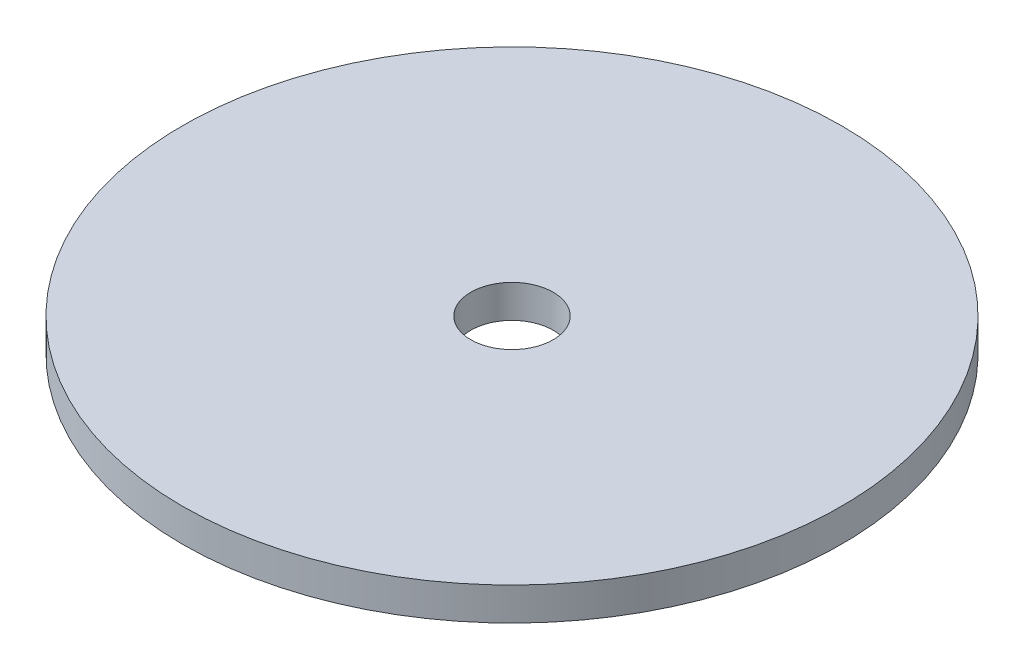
SolidWorks part; units mm, degrees
ref_plane "Front Plane" through (0, 0, 0) normal (0, 0, 1) x (1, 0, 0)
ref_plane "Top Plane" through (0, 0, 0) normal (0, 1, 0) x (1, 0, 0)
ref_plane "Right Plane" through (0, 0, 0) normal (1, 0, 0) x (0, 0, -1)
sketch "Sketch1" plane through (0, 0, 0) normal (0, 1, 0) x (1, 0, 0)
  circle A0 centre (0, 0) radius 20
  circle A1 centre (0, 0) radius 2.5
  dimension "D1" = 40
  dimension "D2" = 5
extrude "Boss-Extrude1" add sketch "Sketch1" along normal blind 2
